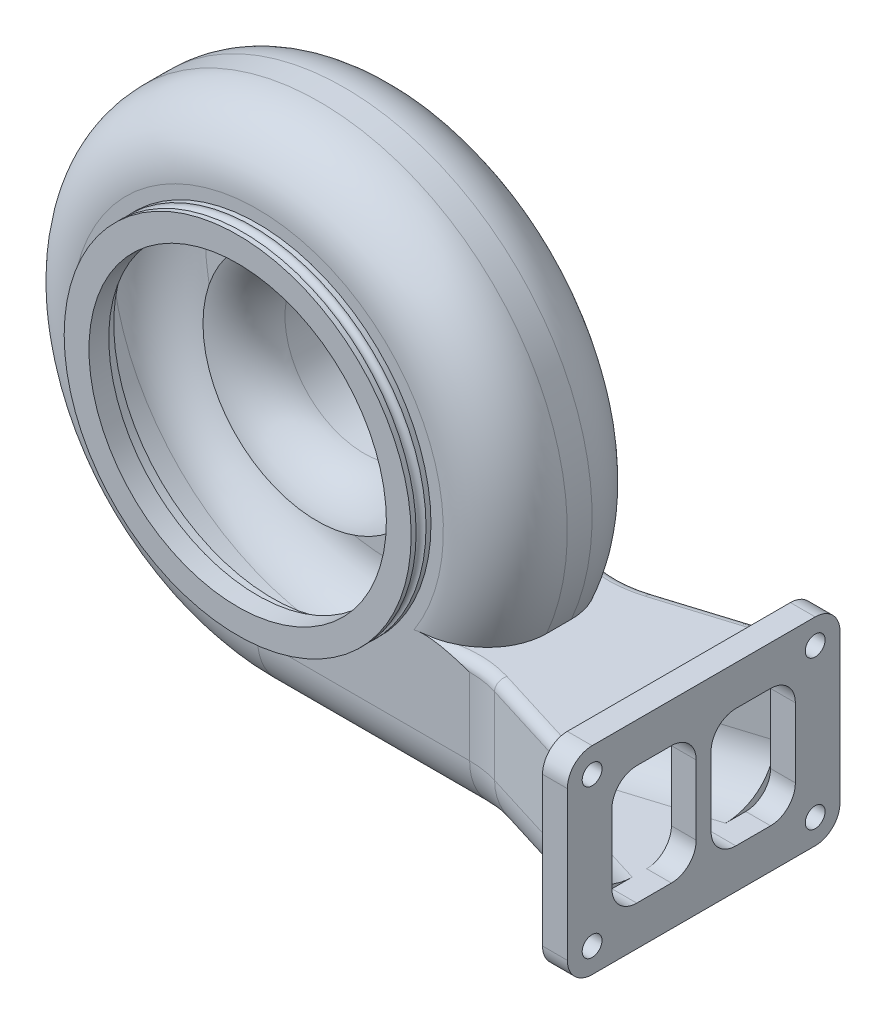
SolidWorks part; units mm, degrees
ref_plane "Front Plane" through (0, 0, 0) normal (0, 0, 1) x (1, 0, 0)
ref_plane "Top Plane" through (0, 0, 0) normal (0, 1, 0) x (1, 0, 0)
ref_plane "Right Plane" through (0, 0, 0) normal (1, 0, 0) x (0, 0, -1)
sketch "Sketch1" plane through (0, 0, 0) normal (0, 0, 1) x (1, 0, 0)
  line L1 (0, -50) -> (70, -50)
  line L3 (45.8258, -20) -> (70, -20)
  line L4 (70, -50) -> (70, -20)
  arc A0 (45.8258, -20) -> (0, -50) centre (0, 0) ccw
  dimension "D1" = 100
  dimension "D2" = 30
  dimension "D3" = 70
extrude "Boss-Extrude1" add sketch "Sketch1" along normal blind 30
sketch "Sketch3" plane through (0, -50, 0) normal (0, -1, 0) x (1, 0, 0)
  line L0 (70, 30) -> (70, 37.5)
  line L1 (70, 37.5) -> (45.8258, 30)
  line L2 (0, 30) -> (70, 30) construction
  line L3 (45.8258, 30) -> (70, 30)
  line L4 (70, 15) -> (38.5668, 15) construction
  line L5 (70, 30) -> (70, 0) construction
  line L6 (45.8258, 0) -> (70, 0)
  line L7 (70, -7.5) -> (45.8258, 0)
  line L8 (70, 0) -> (70, -7.5)
  dimension "D1" = 7.5
extrude "Boss-Extrude2" add sketch "Sketch3" against normal up to surface (30 mm away)
sketch "Sketch4" plane through (70, 0, 0) normal (1, 0, 0) x (0, 0, -1)
  line L10 (-15, -20) -> (-15, -41.0127) construction
  line L11 (-37.5, -20) -> (7.5, -20) construction
  line L12 (-37.5, -50) -> (7.5, -50) construction
  line L13 (-28.5, -23) -> (-21.5, -23)
  line L14 (-42.5, -55) -> (12.5, -55)
  line L15 (12.5, -55) -> (12.5, -15)
  line L16 (12.5, -15) -> (-42.5, -15)
  line L17 (-42.5, -15) -> (-42.5, -55)
  line L18 (-37.5, -55) -> (7.5, -55)
  line L19 (12.5, -50) -> (12.5, -20)
  line L20 (7.5, -15) -> (-37.5, -15)
  line L21 (-42.5, -20) -> (-42.5, -50)
  line L22 (-33.5, -28) -> (-33.5, -42)
  line L23 (-28.5, -47) -> (-21.5, -47)
  line L24 (-16.5, -28) -> (-16.5, -42)
  line L25 (-37.5, -20) -> (-37.5, -50) construction
  line L26 (-13.5, -28) -> (-13.5, -42)
  line L27 (-1.5, -47) -> (-8.5, -47)
  line L28 (3.5, -28) -> (3.5, -42)
  line L29 (-1.5, -23) -> (-8.5, -23)
  arc A0 (-37.5, -55) -> (-42.5, -50) centre (-37.5, -50) cw
  arc A1 (7.5, -55) -> (12.5, -50) centre (7.5, -50) ccw
  arc A2 (12.5, -20) -> (7.5, -15) centre (7.5, -20) ccw
  arc A3 (-37.5, -15) -> (-42.5, -20) centre (-37.5, -20) ccw
  arc A4 (-33.5, -42) -> (-28.5, -47) centre (-28.5, -42) ccw
  arc A5 (-21.5, -47) -> (-16.5, -42) centre (-21.5, -42) ccw
  arc A6 (-21.5, -23) -> (-16.5, -28) centre (-21.5, -28) cw
  arc A7 (-28.5, -23) -> (-33.5, -28) centre (-28.5, -28) ccw
  arc A8 (-1.5, -23) -> (3.5, -28) centre (-1.5, -28) cw
  arc A9 (-8.5, -23) -> (-13.5, -28) centre (-8.5, -28) ccw
  arc A10 (-8.5, -47) -> (-13.5, -42) centre (-8.5, -42) cw
  arc A11 (3.5, -42) -> (-1.5, -47) centre (-1.5, -42) cw
  dimension "D2" = 5
  dimension "D7" = 5
  dimension "D3" = 3
  dimension "D4" = 3
  dimension "D5" = 17
  dimension "D6" = 4
  dimension "D1" = 5
extrude "Boss-Extrude3" add sketch "Sketch4" along normal blind 5
fillet "Fillet1" radius 20 2 edges
sketch "Sketch5" plane through (0, 0, 30) normal (0, 0, 1) x (1, 0, 0)
  circle A0 centre (0, 0) radius 35
  circle A1 centre (0, 0) radius 30
  dimension "D1" = 70
  dimension "D2" = 60
extrude "Boss-Extrude4" add sketch "Sketch5" along normal blind 4
sketch "Sketch6" plane through (0, 0, 0) normal (0, 0, -1) x (-1, 0, 0)
  circle A0 centre (0, 0) radius 20
  dimension "D1" = 40
extrude "Cut-Extrude2" cut sketch "Sketch6" against normal blind 15
sketch "Sketch7" plane through (0, 0, 15) normal (0, 0, -1) x (-1, 0, 0)
  circle A2 centre (0, 0) radius 19
  circle A3 centre (0, 0) radius 19
  dimension "D1" = 1
extrude "Boss-Extrude5" add sketch "Sketch7" along normal blind 30
fillet "Fillet2" radius 2 4 edges at (45.7915, -20, 30.2258) (45.7915, -20, -0.2258) (59.3604, -20, 34.1991) (59.3604, -20, -4.1991)
fillet "Fillet3" radius 12.5 9 edges at (45.7915, -50, 30.2258) (45.7915, -50, -0.2258) (-20, 0, 0) (-26.8167, 42.2003, 30) (-26.8167, 42.2003, 0)
sketch "Sketch8" plane through (75, 0, 0) normal (1, 0, 0) x (0, 0, -1)
  line L0 (-15, -15) -> (-15, -23.7625) construction
  line L1 (7.5, -15) -> (-37.5, -15) construction
  line L2 (-42.5, -35) -> (-34.8786, -35) construction
  line L3 (-42.5, -20) -> (-42.5, -50) construction
  circle A0 centre (-37.5, -20) radius 2
  circle A1 centre (-37.5, -50) radius 2
  circle A2 centre (7.5, -50) radius 2
  circle A3 centre (7.5, -20) radius 2
  dimension "D1" = 4
extrude "Cut-Extrude3" cut sketch "Sketch8" against normal blind 15
sketch "Sketch9" plane through (0, 0, 0) normal (1, 0, 0) x (0, 0, -1)
  line L0 (-30, 35) -> (-34, 35) construction
  line L1 (0, 0) -> (-54.9481, 0) construction
  circle A0 centre (-32, 35) radius 1
  dimension "D1" = 2
revolve "Cut-Revolve1" cut sketch "Sketch9" angle 360 about L1
shell "Shell1" thickness 3
fillet "Fillet4" radius 10 1 edges at (-16, 0, 18)
fillet "Fillet5" radius 10 1 edges at (-19, 0, 15)
